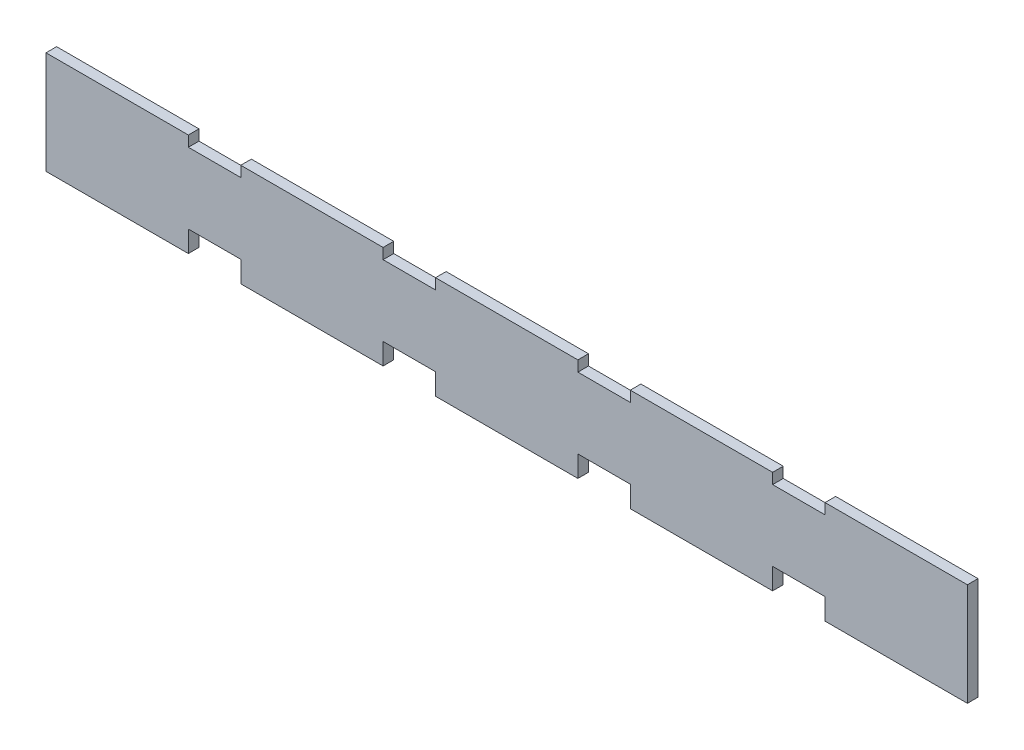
SolidWorks part; units mm, degrees
ref_plane "Front Plane" through (0, 0, 0) normal (0, 0, 1) x (1, 0, 0)
ref_plane "Top Plane" through (0, 0, 0) normal (0, 1, 0) x (1, 0, 0)
ref_plane "Right Plane" through (0, 0, 0) normal (1, 0, 0) x (0, 0, -1)
sketch "Sketch1" plane through (0, 0, 0) normal (0, 0, 1) x (1, 0, 0)
  line L5 (-75.1, -10) -> (-75.1, -16)
  line L6 (89.9, -10) -> (75.1, -10)
  line L56 (130.1, -10) -> (130.1, 10)
  line L57 (89.9, 10) -> (75.1, 10)
  line L58 (-130.1, -10) -> (-130.1, 10)
  line L59 (130.1, -10) -> (-130.1, 10) construction
  line L60 (130.1, 10) -> (-130.1, -10) construction
  line L62 (-130.1, -10) -> (-130.1, -16)
  line L63 (-130.1, -16) -> (-89.9, -16)
  line L64 (-89.9, -10) -> (-89.9, -16)
  line L66 (-34.9, -10) -> (-34.9, -16)
  line L67 (-75.1, -16) -> (-34.9, -16)
  line L68 (-20.1, -10) -> (-20.1, -16)
  line L70 (20.1, -10) -> (20.1, -16)
  line L71 (-20.1, -16) -> (20.1, -16)
  line L72 (34.9, -10) -> (34.9, -16)
  line L74 (75.1, -10) -> (75.1, -16)
  line L75 (34.9, -16) -> (75.1, -16)
  line L76 (89.9, -10) -> (89.9, -16)
  line L78 (130.1, -10) -> (130.1, -16)
  line L79 (89.9, -16) -> (130.1, -16)
  line L80 (-75.1, 10) -> (-75.1, 13)
  line L82 (-130.1, 10) -> (-130.1, 13)
  line L83 (-130.1, 13) -> (-89.9, 13)
  line L84 (-89.9, 10) -> (-89.9, 13)
  line L86 (-34.9, 10) -> (-34.9, 13)
  line L87 (-75.1, 13) -> (-34.9, 13)
  line L88 (-20.1, 10) -> (-20.1, 13)
  line L90 (20.1, 10) -> (20.1, 13)
  line L91 (-20.1, 13) -> (20.1, 13)
  line L92 (34.9, 10) -> (34.9, 13)
  line L94 (75.1, 10) -> (75.1, 13)
  line L95 (34.9, 13) -> (75.1, 13)
  line L96 (89.9, 10) -> (89.9, 13)
  line L98 (130.1, 10) -> (130.1, 13)
  line L99 (89.9, 13) -> (130.1, 13)
  line L100 (-75.1, -10) -> (-89.9, -10)
  line L101 (-75.1, 10) -> (-89.9, 10)
  line L102 (-20.1, -10) -> (-34.9, -10)
  line L103 (-20.1, 10) -> (-34.9, 10)
  line L104 (34.9, 10) -> (20.1, 10)
  line L105 (34.9, -10) -> (20.1, -10)
  point P0 (0, 0)
  dimension "D1" = 260.2
  dimension "D2" = 20
  dimension "D3" = 6
  dimension "D4" = 40.2
  dimension "D5" = 40.2
  dimension "D6" = 3
extrude "Boss-Extrude1" add sketch "Sketch1" along normal blind 3
